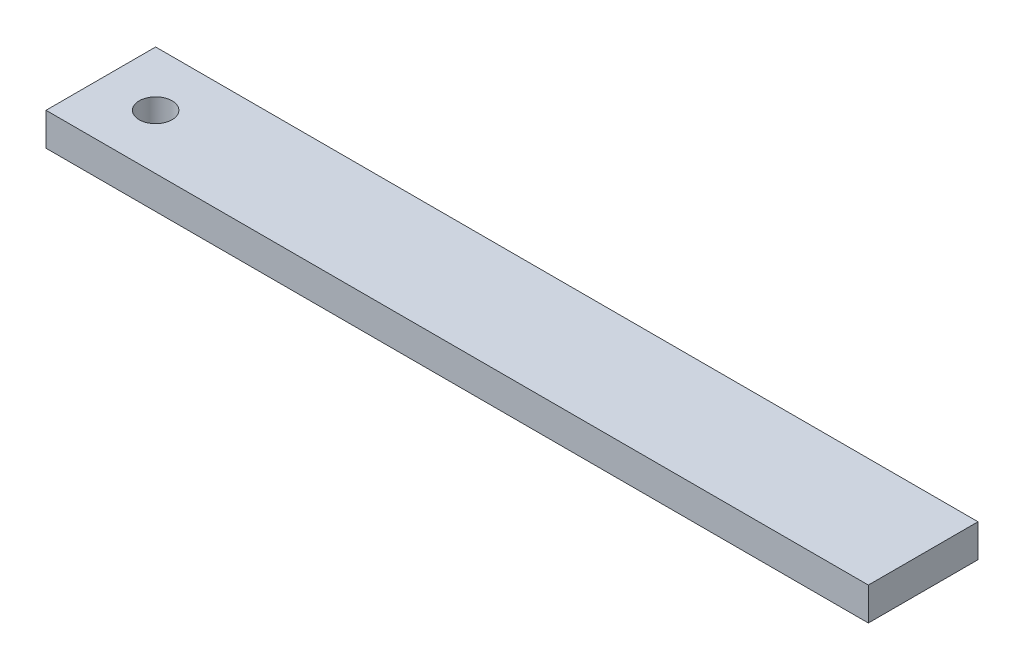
SolidWorks part; units mm, degrees
ref_plane "Front Plane" through (0, 0, 0) normal (0, 0, 1) x (1, 0, 0)
ref_plane "Top Plane" through (0, 0, 0) normal (0, 1, 0) x (1, 0, 0)
ref_plane "Right Plane" through (0, 0, 0) normal (1, 0, 0) x (0, 0, -1)
sketch "Sketch1" plane through (0, 0, 0) normal (0, 1, 0) x (1, 0, 0)
  line L0 (-37.5, 0) -> (37.5, 0) construction
  line L1 (37.5, 5) -> (-37.5, 5)
  line L2 (37.5, 5) -> (37.5, -5)
  line L3 (37.5, -5) -> (-37.5, -5)
  line L4 (-37.5, 5) -> (-37.5, -5)
  line L5 (37.5, 5) -> (-37.5, -5) construction
  line L6 (37.5, -5) -> (-37.5, 5) construction
  circle A0 centre (-32.5, 0) radius 1.5
  point P0 (0, 0)
  dimension "D3" = 3
  dimension "D1" = 10
  dimension "D2" = 75
  dimension "D4" = 5
extrude "Boss-Extrude1" add sketch "Sketch1" along normal blind 3
